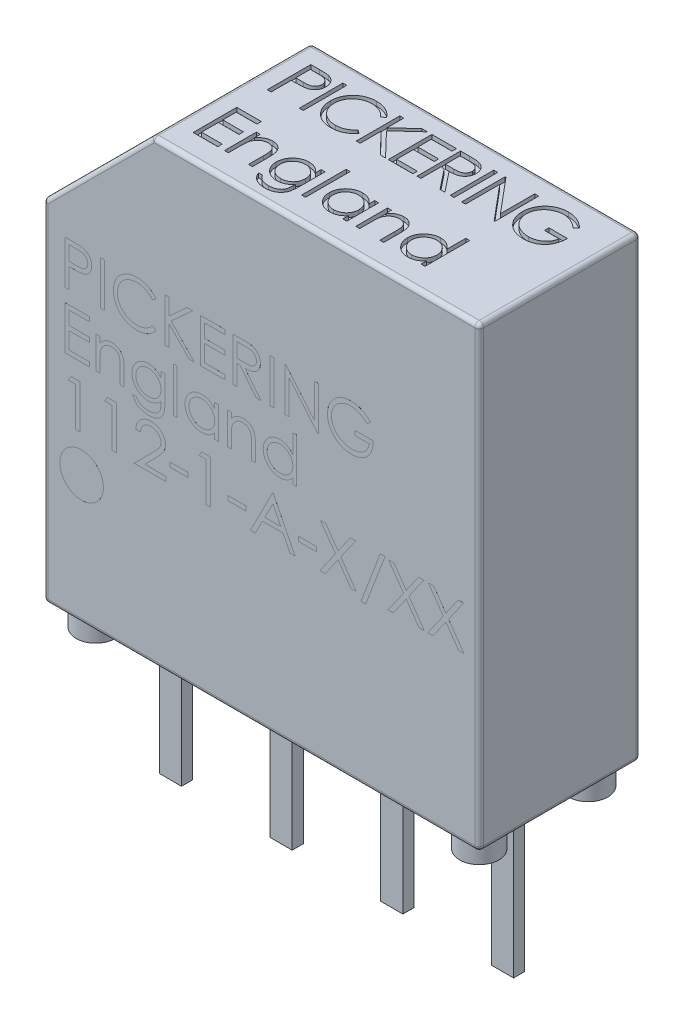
SolidWorks part; units mm, degrees
ref_plane "Front Plane" through (0, 0, 0) normal (0, 0, 1) x (1, 0, 0)
ref_plane "Top Plane" through (0, 0, 0) normal (0, 1, 0) x (1, 0, 0)
ref_plane "Right Plane" through (0, 0, 0) normal (1, 0, 0) x (0, 0, -1)
sketch "Sketch1" plane through (0, 0, 0) normal (0, 1, 0) x (1, 0, 0)
  line L1 (5, -1.85) -> (-5, -1.85)
  line L2 (5, -1.85) -> (5, 1.85)
  line L3 (5, 1.85) -> (-5, 1.85)
  line L4 (-5, -1.85) -> (-5, 1.85)
  line L5 (5, -1.85) -> (-5, 1.85) construction
  line L6 (5, 1.85) -> (-5, -1.85) construction
  point P0 (0, 0)
  dimension "D1" = 3.7
  dimension "D2" = 10
extrude "Main Body" add sketch "Sketch1" along normal blind 10.492
sketch "Sketch2" plane through (0, 0, 1.85) normal (0, 0, 1) x (1, 0, 0)
  line L0 (-2.5, 10.492) -> (-5, 7.992)
  line L1 (-5, 10.492) -> (5, 10.492) construction
  line L2 (-5, 10.492) -> (-5, 0) construction
  line L3 (-5, 10.492) -> (-5, 7.992)
  line L4 (-5, 10.492) -> (-2.5, 10.492)
  dimension "D1" = 7.5
  dimension "D2" = 45
extrude "Shaping Cut" cut sketch "Sketch2" against normal through all
sketch "Sketch3" plane through (0, 0, 0) normal (0, -1, 0) x (1, 0, 0)
  line L0 (-5, 1.85) -> (5, 1.85) construction
  line L2 (-5, -1.85) -> (-5, 1.85) construction
  line L3 (5, -1.85) -> (-5, -1.85) construction
  line L4 (5, 1.85) -> (5, -1.85) construction
  circle A0 centre (-4.4, 1.25) radius 0.45
  circle A1 centre (-4.4, -1.25) radius 0.45
  circle A2 centre (4.4, -1.25) radius 0.45
  circle A3 centre (4.4, 1.25) radius 0.45
  dimension "D1" = 0.9
  dimension "D4" = 0.9
  dimension "D6" = 0.9
  dimension "D8" = 0.9
  dimension "D2" = 0.6
  dimension "D3" = 0.6
  dimension "D5" = 0.6
  dimension "D7" = 0.6
  dimension "D9" = 0.6
  dimension "D10" = 0.6
  dimension "D11" = 0.6
  dimension "D12" = 0.6
extrude "Feet" add sketch "Sketch3" along normal blind 0.508
sketch "Sketch4" plane through (0, 0, 0) normal (0, -1, 0) x (1, 0, 0)
  line L0 (5, 1.85) -> (5, -1.85) construction
  line L1 (-4.064, -0.127) -> (-3.556, -0.127)
  line L2 (-4.064, -0.127) -> (-4.064, 0.127)
  line L3 (-4.064, 0.127) -> (-3.556, 0.127)
  line L4 (-3.556, -0.127) -> (-3.556, 0.127)
  line L5 (-4.064, -0.127) -> (-3.556, 0.127) construction
  line L6 (-4.064, 0.127) -> (-3.556, -0.127) construction
  line L7 (-1.016, -0.127) -> (-1.524, -0.127)
  line L8 (-1.016, -0.127) -> (-1.016, 0.127)
  line L9 (-1.016, 0.127) -> (-1.524, 0.127)
  line L10 (-1.524, -0.127) -> (-1.524, 0.127)
  line L11 (-1.016, -0.127) -> (-1.524, 0.127) construction
  line L12 (-1.016, 0.127) -> (-1.524, -0.127) construction
  line L13 (1.016, -0.127) -> (1.524, -0.127)
  line L14 (1.016, -0.127) -> (1.016, 0.127)
  line L15 (1.016, 0.127) -> (1.524, 0.127)
  line L16 (1.524, -0.127) -> (1.524, 0.127)
  line L17 (1.016, -0.127) -> (1.524, 0.127) construction
  line L18 (1.016, 0.127) -> (1.524, -0.127) construction
  line L19 (3.556, -0.127) -> (4.064, -0.127)
  line L20 (3.556, -0.127) -> (3.556, 0.127)
  line L21 (3.556, 0.127) -> (4.064, 0.127)
  line L22 (4.064, -0.127) -> (4.064, 0.127)
  line L23 (3.556, -0.127) -> (4.064, 0.127) construction
  line L24 (3.556, 0.127) -> (4.064, -0.127) construction
  point P0 (-3.81, 0)
  point P5 (-1.27, 0)
  point P10 (1.27, 0)
  point P15 (3.81, 0)
  dimension "D1" = 0.254
  dimension "D2" = 0.508
  dimension "D3" = 0.254
  dimension "D4" = 0.508
  dimension "D5" = 0.254
  dimension "D6" = 0.508
  dimension "D7" = 0.254
  dimension "D8" = 0.508
  dimension "D9" = 2.54
  dimension "D10" = 2.54
  dimension "D11" = 2.54
  dimension "D12" = 1.19
extrude "Pins" add sketch "Sketch4" along normal blind 3.808
sketch "Sketch5"
  dimension "D1" = 1.45
  dimension "D2" = 1.7
extrude "Top Lettering" cut sketch "Sketch5" against normal blind 0.1
sketch "Sketch6"
  dimension "D4" = 1
  dimension "D1" = 4
  dimension "D2" = 1.3
  dimension "D3" = 1.4
extrude "Front Lettering" add sketch "Sketch6" along normal blind 0.0001
fillet "Fillet1" radius 0.1 15 edges at (5, 5.246, 1.85) (5, 10.492, 0) (5, 0, 0) (-2.5, 10.492, 0) (-3.75, 9.242, 1.85) (-5, 0, 0) (-5, 7.992, 0) (-5, 3.996, 1.85) (0, 0, -1.85) (5, 5.246, -1.85) (1.25, 10.492, -1.85) (-3.75, 9.242, -1.85) (-5, 3.996, -1.85) (1.25, 10.492, 1.85) (0, 0, 1.85)
